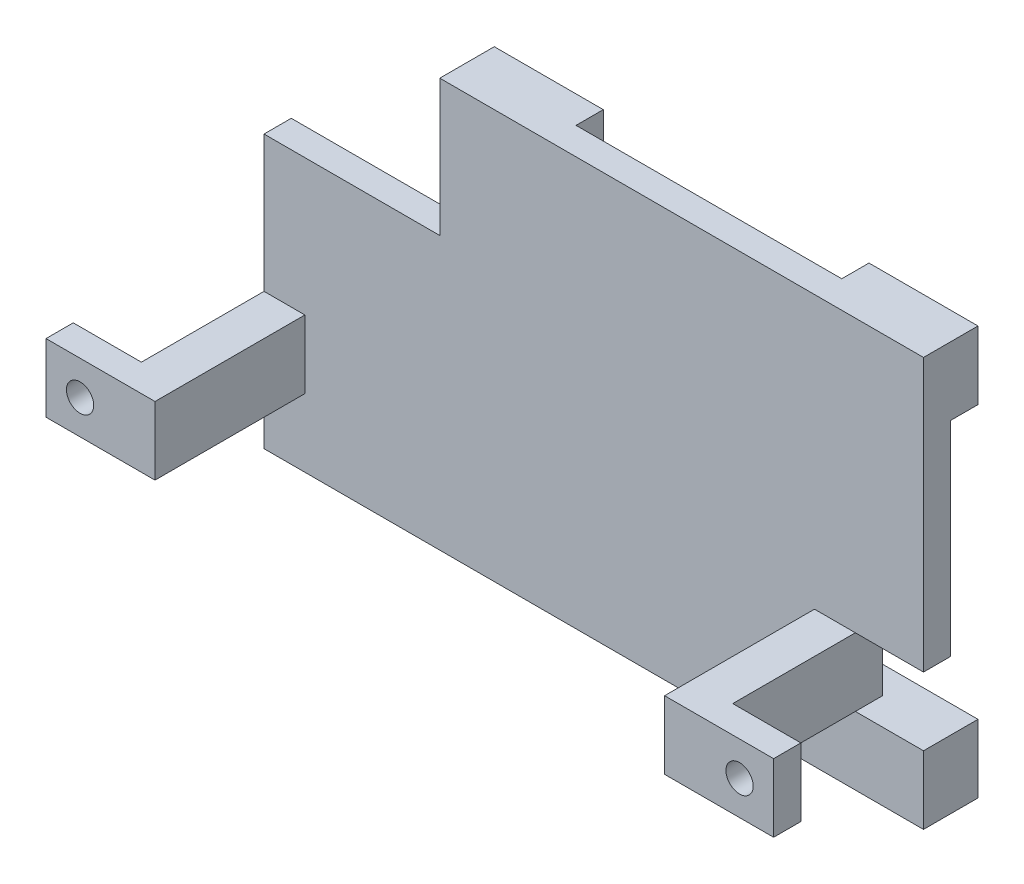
SolidWorks part; units mm, degrees
ref_plane "Alzado" through (0, 0, 0) normal (0, 0, 1) x (1, 0, 0)
ref_plane "Planta" through (0, 0, 0) normal (0, 1, 0) x (1, 0, 0)
ref_plane "Vista lateral" through (0, 0, 0) normal (1, 0, 0) x (0, 0, -1)
sketch "Croquis1" plane through (0, 0, 0) normal (0, 0, 1) x (1, 0, 0)
  line L1 (-0.3876, 13.329) -> (48.0124, 13.329)
  line L2 (-0.3876, 13.329) -> (-0.3876, -16.671)
  line L3 (-0.3876, -16.671) -> (48.0124, -16.671)
  line L4 (48.0124, 13.329) -> (48.0124, -16.671)
  dimension "D1" = 30
  dimension "D2" = 48.4
extrude "Saliente-Extruir1" add sketch "Croquis1" along normal blind 2
sketch "Croquis2" plane through (0, 0, 2) normal (0, 0, 1) x (1, 0, 0)
  line L0 (-0.3876, -6.671) -> (48.0124, -6.671) construction
  line L1 (-0.3876, 13.329) -> (-0.3876, -16.671) construction
  line L2 (48.0124, -16.671) -> (48.0124, 13.329) construction
  line L3 (48.0124, 13.329) -> (-0.3876, 13.329) construction
  line L4 (-0.3876, -11.671) -> (48.0124, -11.671) construction
  line L5 (43.0124, -11.671) -> (43.0124, -6.671)
  line L6 (-0.3876, -16.671) -> (48.0124, -16.671) construction
  line L7 (43.0124, -11.671) -> (43.0124, -6.671) construction
  line L8 (43.0124, -6.671) -> (48.0124, -6.671)
  line L9 (48.0124, -6.671) -> (48.0124, -11.671)
  line L10 (48.0124, -11.671) -> (43.0124, -11.671)
  dimension "D1" = 20
  dimension "D2" = 5
  dimension "D3" = 5
  dimension "D4" = 5
extrude "Cortar-Extruir1" cut sketch "Croquis2" against normal blind 2
sketch "Croquis3" plane through (0, 0, 2) normal (0, 0, 1) x (1, 0, 0)
  line L0 (43.0124, -6.671) -> (43.0124, -11.671)
  line L1 (43.0124, -6.671) -> (40.0124, -6.671)
  line L2 (43.0124, -11.671) -> (40.0124, -11.671)
  line L3 (40.0124, -6.671) -> (40.0124, -11.671)
  line L4 (40.0124, -11.671) -> (-0.3876, -11.671) construction
  line L5 (-0.3876, 13.329) -> (-0.3876, -16.671) construction
  line L7 (-0.3876, -11.671) -> (2.6124, -11.671)
  line L8 (-0.3876, -11.671) -> (-0.3876, -6.671)
  line L9 (-0.3876, -6.671) -> (2.6124, -6.671)
  line L10 (2.6124, -11.671) -> (2.6124, -6.671)
  dimension "D1" = 3
  dimension "D2" = 5
  dimension "D3" = 3
extrude "Saliente-Extruir2" add sketch "Croquis3" along normal blind 11
sketch "Croquis4" plane through (0, 0, 13) normal (0, 0, 1) x (1, 0, 0)
  line L0 (-0.3876, -11.671) -> (-0.3876, -6.671)
  line L1 (-0.3876, -11.671) -> (-5.3876, -11.671)
  line L2 (-0.3876, -6.671) -> (-5.3876, -6.671)
  line L3 (-5.3876, -11.671) -> (-5.3876, -6.671)
  line L4 (43.0124, -6.671) -> (43.0124, -11.671)
  line L5 (43.0124, -6.671) -> (48.0124, -6.671)
  line L6 (43.0124, -11.671) -> (48.0124, -11.671)
  line L7 (48.0124, -6.671) -> (48.0124, -11.671)
  line L8 (-5.3876, -11.671) -> (-0.3876, -6.671) construction
  line L9 (-5.3876, -6.671) -> (-0.3876, -11.671) construction
  line L10 (43.0124, -11.671) -> (48.0124, -6.671) construction
  line L11 (48.0124, -11.671) -> (43.0124, -6.671) construction
  circle A0 centre (-2.8876, -9.171) radius 1
  circle A1 centre (45.5124, -9.171) radius 1
  point P0 (-2.8876, -9.171)
  point P15 (45.5124, -9.171)
  dimension "D3" = 2
  dimension "D4" = 2
  dimension "D1" = 5
  dimension "D2" = 5
extrude "Saliente-Extruir3" add sketch "Croquis4" against normal blind 2
sketch "Croquis5" plane through (0, 0, 0) normal (0, 0, -1) x (-1, 0, 0)
  line L0 (-48.0124, -16.671) -> (-48.0124, -11.671)
  line L1 (-48.0124, -16.671) -> (-40.0124, -16.671)
  line L2 (-48.0124, -11.671) -> (-40.0124, -11.671)
  line L3 (-40.0124, -16.671) -> (-40.0124, -11.671)
  line L4 (-12.5124, -16.671) -> (-12.5124, 13.329) construction
  line L5 (0.3876, -16.671) -> (-48.0124, -16.671) construction
  line L6 (-48.0124, 13.329) -> (0.3876, 13.329) construction
  line L7 (-12.5124, -16.671) -> (-12.5124, -11.671)
  line L8 (-12.5124, -16.671) -> (-20.5124, -16.671)
  line L9 (-12.5124, -11.671) -> (-20.5124, -11.671)
  line L10 (-20.5124, -16.671) -> (-20.5124, -11.671)
  line L11 (-12.5124, 13.329) -> (-12.5124, 8.329)
  line L12 (-12.5124, 13.329) -> (-20.5124, 13.329)
  line L13 (-12.5124, 8.329) -> (-20.5124, 8.329)
  line L14 (-20.5124, 13.329) -> (-20.5124, 8.329)
  line L15 (-48.0124, 13.329) -> (-48.0124, 8.329)
  line L16 (-48.0124, 13.329) -> (-40.0124, 13.329)
  line L17 (-48.0124, 8.329) -> (-40.0124, 8.329)
  line L18 (-40.0124, 13.329) -> (-40.0124, 8.329)
  line L20 (-48.0124, -6.671) -> (-48.0124, 13.329) construction
  line L21 (-45.5124, -11.671) -> (-45.5124, -16.671) construction
  line L22 (-45.5124, -15.171) -> (-40.0124, -15.171) construction
  line L23 (-45.5124, -13.171) -> (-40.0124, -13.171) construction
  line L24 (-12.5124, -15.171) -> (-20.5124, -15.171) construction
  line L25 (-45.5124, 8.329) -> (-45.5124, 13.329) construction
  line L26 (-45.5124, 11.829) -> (-12.5124, 11.829) construction
  line L27 (-40.0124, 9.829) -> (-45.5124, 9.829) construction
  line L28 (-20.5124, -13.171) -> (-12.5124, -13.171) construction
  line L29 (-20.5124, 9.829) -> (-12.5124, 9.829) construction
  line L30 (-13.5124, 13.329) -> (-13.5124, -16.2598) construction
  circle A0 centre (-44.5124, -14.171) radius 1
  circle A1 centre (-44.5124, 10.829) radius 1
  circle A2 centre (-14.5124, 10.829) radius 1
  circle A3 centre (-14.5124, -14.171) radius 1
  dimension "D1" = 8
  dimension "D2" = 35.5
  dimension "D3" = 5
  dimension "D4" = 8
  dimension "D5" = 8
  dimension "D6" = 5
  dimension "D7" = 8
  dimension "D8" = 5
  dimension "D9" = 2.5
  dimension "D10" = 1.5
  dimension "D11" = 2
  dimension "D12" = 1.5
  dimension "D13" = 2
  dimension "D14" = 1
extrude "Saliente-Extruir4" add sketch "Croquis5" along normal blind 2
sketch "Croquis7" plane through (0, 0, 0) normal (0, 0, -1) x (-1, 0, 0)
  line L0 (0.3876, 13.329) -> (-12.5124, 13.329)
  line L1 (0.3876, 13.329) -> (0.3876, 3.329)
  line L2 (-12.5124, 13.329) -> (-12.5124, 3.329)
  line L3 (0.3876, 3.329) -> (-12.5124, 3.329)
  dimension "D1" = 10
extrude "Cortar-Extruir2" cut sketch "Croquis7" against normal blind 10
